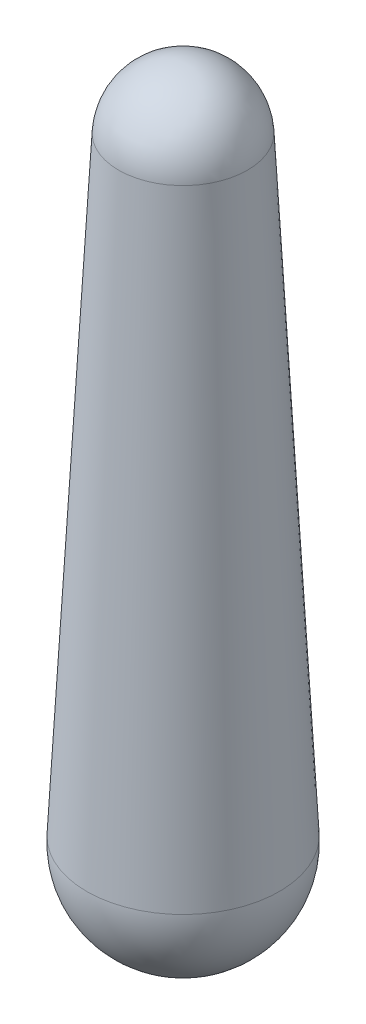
SolidWorks part; units mm, degrees
ref_plane "vorne" through (0, 0, 0) normal (0, 0, 1) x (1, 0, 0)
ref_plane "oben" through (0, 0, 0) normal (0, 1, 0) x (1, 0, 0)
ref_plane "seite" through (0, 0, 0) normal (1, 0, 0) x (0, 0, -1)
sketch "Skizze1" plane through (0, 0, 0) normal (0, 0, 1) x (1, 0, 0)
  line L0 (0, 0) -> (0, 40) construction
  line L1 (0, 0) -> (-7.2648, 0) construction
  line L2 (3.3386, 36.8318) -> (4.9931, 5.2617)
  line L3 (0, 40) -> (-7.2648, 40) construction
  line L4 (0, 40) -> (0, 0)
  line L5 (0, 0) -> (0, -9.0162) construction
  arc A0 (0, 0) -> (4.9931, 5.2617) centre (0, 5) ccw
  arc A1 (0, 40) -> (3.3386, 36.8318) centre (0, 36.6568) cw
  dimension "D4" = 9.9863
  dimension "D2" = 5
  dimension "D1" = 40
  dimension "D3" = 3
revolve "Rotation1" add sketch "Skizze1" angle 360 about L5
